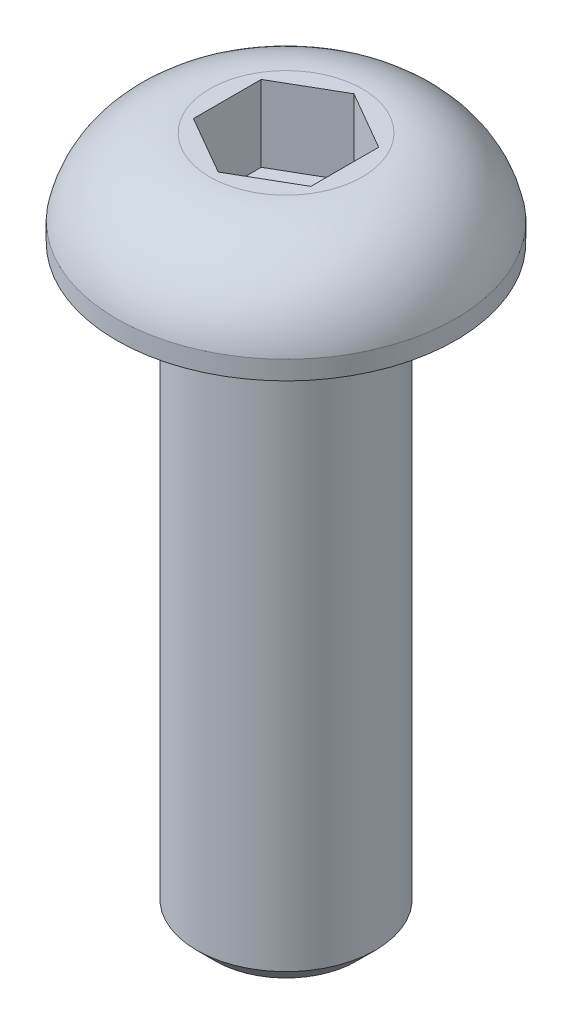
SolidWorks part; units mm, degrees
ref_plane "Plane1" through (0, 0, 0) normal (0, 0, 1) x (1, 0, 0)
ref_plane "Plane2" through (0, 0, 0) normal (0, 1, 0) x (1, 0, 0)
ref_plane "Plane3" through (0, 0, 0) normal (1, 0, 0) x (0, 0, -1)
sketch "Sketch1" plane through (0, 0, 0) normal (0, 0, 1) x (1, 0, 0)
  line L0 (0, 0) -> (2.0637, 0)
  line L1 (2.413, -2.5654) -> (4.5847, -2.5654)
  line L2 (4.5847, -2.0574) -> (4.5847, -2.5654)
  line L4 (2.413, -2.5654) -> (2.413, -18.4404)
  line L5 (0, 25.4) -> (0, -50.8) construction
  line L6 (2.413, -18.4404) -> (0, -18.4404)
  line L7 (0, 0) -> (0, -18.4404)
  arc A0 (2.0637, 0) -> (4.5847, -2.0574) centre (2.0637, -2.5732) cw
  dimension "FlatFace" = 0.508
  dimension "NominalDia" = 4.826
  dimension "CapDia" = 9.1694
  dimension "FlatDia" = 4.1275
revolve "Screw" add sketch "Sketch1" angle 360 about L5
sketch "Sketch2" plane through (0, 0, 0) normal (0, 1, 0) x (-1, 0, 0)
  line L0 (0, -5.08) -> (0, 5.08) construction
  line L1 (11.7475, 0) -> (-14.9225, 0) construction
  line L2 (-1.5875, -0.9165) -> (-1.5875, 0.9165)
  line L3 (0, 1.8331) -> (-1.5875, 0.9165)
  line L4 (0, 1.8331) -> (1.5875, 0.9165)
  line L5 (1.5875, -0.9165) -> (1.5875, 0.9165)
  line L6 (0, -1.8331) -> (-1.5875, -0.9165)
  line L7 (0, -1.8331) -> (1.5875, -0.9165)
  point P8 (-1.5875, 0)
  dimension "D1" = 120
extrude "HexCut" cut sketch "Sketch2" against normal blind 2.0574
sketch "Sketch3" plane through (0, -2.5654, 0) normal (0, -1, 0) x (1, 0, 0)
  circle A0 centre (0, 0) radius 4.5847 construction
  circle A1 centre (0, 0) radius 4.5847 construction
  point P0 (0, 4.5847)
  point P1 (0, -4.5847)
  point P6 (4.5847, 0)
  point P7 (-4.5847, 0)
sketch "Sketch4" plane through (0, -18.4404, 0) normal (0, -1, 0) x (1, 0, 0)
  circle A0 centre (0, 0) radius 1.1811
  dimension "D1" = 2.3622
extrude "Cut-Extrude1" cut sketch "Sketch4" against normal through all
chamfer "Chamfer1" distance 0.508 angle 45 1 edges at (0, -18.4404, 2.413)
equation "\"FlatDia@Sketch1\"=\"HexWidth@Sketch2\"*1.3"
equation "\"Depth@HexCut\"=\"CapHeight@Sketch1\"-\"FlatFace@Sketch1\""
